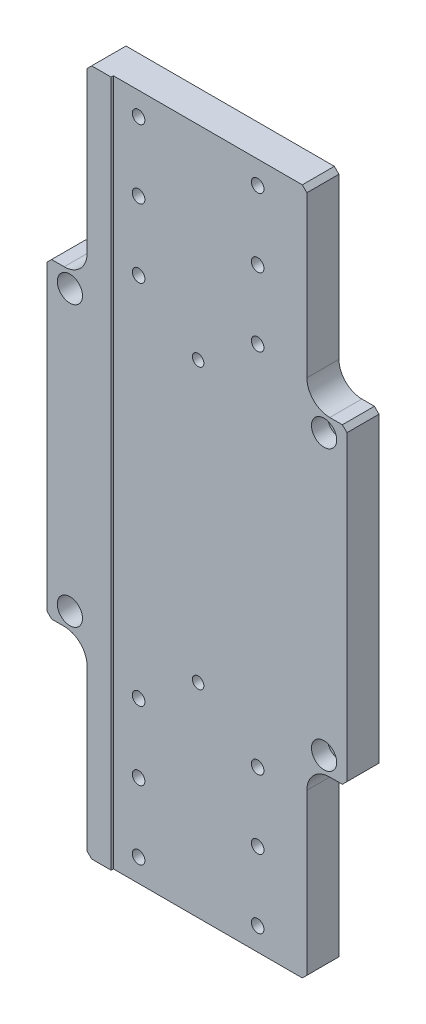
SolidWorks part; units mm, degrees
ref_plane "정면" through (0, 0, 0) normal (0, 0, 1) x (1, 0, 0)
ref_plane "윗면" through (0, 0, 0) normal (0, 1, 0) x (1, 0, 0)
ref_plane "우측면" through (0, 0, 0) normal (1, 0, 0) x (0, 0, -1)
sketch "스케치1" plane through (0, 0, 0) normal (0, 0, 1) x (1, 0, 0)
  line L1 (-65, 68) -> (65, 68)
  line L2 (-65, 68) -> (-65, -68)
  line L3 (-65, -68) -> (65, -68)
  line L4 (65, 68) -> (65, -68)
  line L5 (-47.5, 150) -> (47.5, 150)
  line L6 (-47.5, 150) -> (-47.5, -150)
  line L7 (-47.5, -150) -> (47.5, -150)
  line L8 (47.5, 150) -> (47.5, -150)
  line L9 (-47.5, 150) -> (47.5, -150) construction
  line L10 (-47.5, -150) -> (47.5, 150) construction
  point P4 (0, 0)
  point P10 (0, 68)
  dimension "D1" = 136
  dimension "D2" = 82
  dimension "D3" = 82
  dimension "D4" = 95
  dimension "D5" = 17.5
  dimension "D6" = 17.5
extrude "보스-돌출1" add sketch "스케치1" along normal mid plane 15 contours L5 L8 L7 L6 | L4 L3 L2 L1
sketch "스케치2" plane through (0, 0, 7.5) normal (0, 0, 1) x (1, 0, 0)
  line L0 (-47.5, 150) -> (47.5, 150) construction
  line L1 (-37, 150) -> (65, 150)
  line L2 (-37, 150) -> (-37, -150)
  line L3 (-37, -150) -> (65, -150)
  line L4 (65, 150) -> (65, -150)
  line L5 (65, 68) -> (65, -68) construction
  line L6 (-47.5, -150) -> (47.5, -150) construction
  line L7 (-65, 68) -> (-65, -68) construction
  dimension "D1" = 28
extrude "컷-돌출1" cut sketch "스케치2" against normal blind 1
hole_wizard "M6 소켓 머리 캡 나사용 카운터보어1" positions "스케치3" profile "스케치4" counterbore size "M6" standard "KS"
sketch "스케치3" plane through (0, 0, 7.5) normal (0, 0, 1) x (1, 0, 0)
  line L0 (47.5, 150) -> (-37, 150) construction
  line L1 (-65, 68) -> (-65, -68) construction
  point P0 (-55, 61)
  point P2 (55, 61)
  point P4 (-55, -61)
  point P6 (55, -61)
  dimension "D1" = 122
  dimension "D2" = 89
  dimension "D3" = 10
  dimension "D4" = 110
sketch "스케치4" plane through (-55, 61, 7.5) normal (1, 0, 0) x (0, -1, 0)
  line L0 (0, 0) -> (0, 15)
  line L1 (0, 15) -> (3.3, 15)
  line L3 (3.3, 15) -> (3.3, 8)
  line L4 (3.3, 8) -> (5.5, 8)
  line L5 (5.5, 8) -> (5.5, 0)
  line L7 (5.5, 0) -> (0, 0)
  line L11 (0, -6.35) -> (0, 107.95) construction
  dimension "관통 구멍 지름" = 6.6
  dimension "관통 구멍 깊이" = 15
  dimension "카운터보어 지름" = 11
  dimension "카운터보어 깊이" = 8
hole_wizard "M5 소켓 머리 캡 나사용 카운터보어1" positions "스케치5" profile "스케치6" counterbore size "M5" standard "KS"
sketch "스케치5" plane through (0, 0, -7.5) normal (0, 0, -1) x (-1, 0, 0)
  line L0 (-47.5, 150) -> (-47.5, 68) construction
  line L1 (47.5, 150) -> (-47.5, 150) construction
  point P0 (-26, 140)
  point P2 (26, 140)
  point P4 (-26, 110)
  point P6 (26, 110)
  point P8 (-26, 80)
  point P10 (26, 80)
  dimension "D1" = 21.5
  dimension "D2" = 52
  dimension "D3" = 10
  dimension "D4" = 30
  dimension "D5" = 30
sketch "스케치6" plane through (26, 140, -7.5) normal (1, 0, 0) x (0, 1, 0)
  line L0 (0, 0) -> (0, 15)
  line L1 (0, 15) -> (2.75, 15)
  line L3 (2.75, 15) -> (2.75, 7)
  line L4 (2.75, 7) -> (4.75, 7)
  line L5 (4.75, 7) -> (4.75, 0)
  line L7 (4.75, 0) -> (0, 0)
  line L11 (0, -6.35) -> (0, 107.95) construction
  dimension "관통 구멍 지름" = 5.5
  dimension "관통 구멍 깊이" = 15
  dimension "카운터보어 지름" = 9.5
  dimension "카운터보어 깊이" = 7
pattern_linear "선형 패턴1" count 2 spacing 220 along (0, -1, 0) of "M5 소켓 머리 캡 나사용 카운터보어1"
hole_wizard "Ø5.0mm 맞춤핀 구멍1" positions "스케치7" profile "스케치8" hole size "Ø5.0" standard "ISO"
sketch "스케치7" plane through (0, 0, 6.5) normal (0, 0, 1) x (1, 0, 0)
  line L0 (0, 0) -> (0, 160.2418) construction
  line L1 (47.5, 150) -> (-37, 150) construction
  point P6 (0, 61)
  point P8 (0, -61)
  dimension "D1" = 89
  dimension "D2" = 122
sketch "스케치8" plane through (0, -61, 6.5) normal (1, 0, 0) x (0, -1, 0)
  line L0 (0, 0) -> (0, 14)
  line L1 (0, 14) -> (2.5, 14)
  line L2 (2.5, 14) -> (2.5, 0)
  line L5 (2.5, 0) -> (0, 0)
  line L11 (0, -6.35) -> (0, 107.95) construction
  dimension "관통 구멍 지름" = 5
  dimension "관통 구멍 깊이" = 14
fillet "필렛1" radius 10 4 edges at (-47.5, 68, 0) (-47.5, -68, 0) (47.5, -68, -0.5) (47.5, 68, -0.5)
chamfer "모따기1" distance 2 angle 45 8 edges at (65, -68, -0.5) (47.5, -150, -0.5) (-47.5, -150, 0) (-65, -68, 0) (65, 68, -0.5) (47.5, 150, -0.5) (-65, 68, 0) (-47.5, 150, 0)
